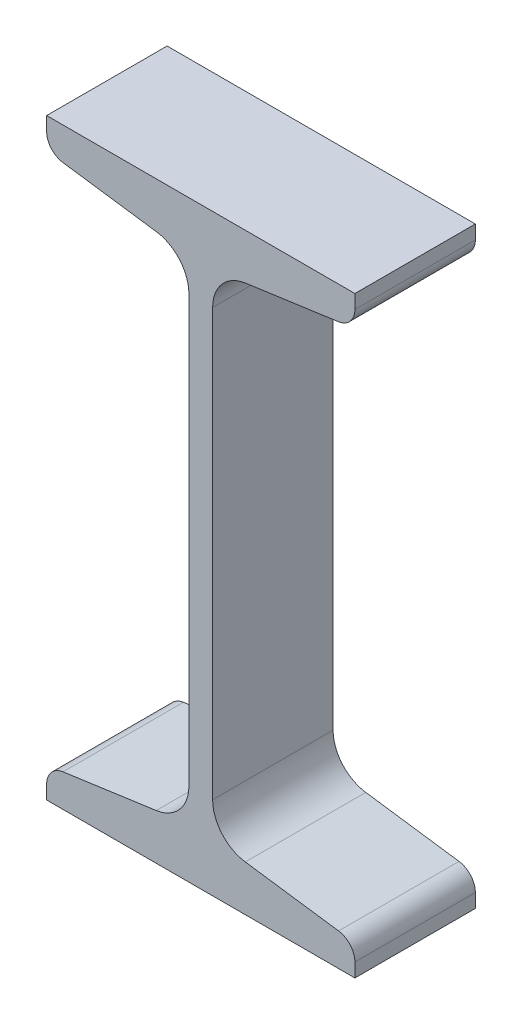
SolidWorks part; units mm, degrees
ref_plane "Front Plane" through (0, 0, 0) normal (0, 0, 1) x (1, 0, 0)
ref_plane "Top Plane" through (0, 0, 0) normal (0, 1, 0) x (1, 0, 0)
ref_plane "Right Plane" through (0, 0, 0) normal (1, 0, 0) x (0, 0, -1)
other "Configuration Table"
sketch "Sketch1" plane through (0, 0, 0) normal (0, 0, 1) x (1, 0, 0)
  line L0 (0, 72.9931) -> (0, -63.9253) construction
  line L1 (-32.5, 62.5) -> (32.5, 62.5)
  line L2 (-32.5, 62.5) -> (-32.5, 59.5853)
  line L3 (-32.5, -62.5) -> (32.5, -62.5)
  line L4 (32.5, -59.5853) -> (32.5, -62.5)
  line L5 (-42.3074, 0) -> (60.8749, 0) construction
  line L6 (-32.5, -59.5853) -> (-32.5, -62.5)
  line L7 (-29.0567, 55.6242) -> (-9.3866, 52.8597)
  line L8 (29.0567, -55.6242) -> (9.3866, -52.8597)
  line L9 (-29.0567, -55.6242) -> (-9.3866, -52.8597)
  line L10 (-2.5, 44.9376) -> (-2.5, -44.9376)
  line L11 (2.5, 44.9376) -> (2.5, -44.9376)
  line L12 (29.0567, 55.6242) -> (9.3866, 52.8597)
  line L13 (32.5, 62.5) -> (32.5, 59.5853)
  line L14 (-32.5, 21.4066) -> (-2.5, 21.4066) construction
  line L15 (-17.5, 62.5) -> (-17.5, 54) construction
  line L16 (-17.5, 54) -> (-17.5, 21.4066) construction
  arc A0 (-9.3866, 52.8597) -> (-2.5, 44.9376) centre (-10.5, 44.9376) cw
  arc A1 (-9.3866, -52.8597) -> (-2.5, -44.9376) centre (-10.5, -44.9376) ccw
  arc A2 (9.3866, -52.8597) -> (2.5, -44.9376) centre (10.5, -44.9376) cw
  arc A3 (9.3866, 52.8597) -> (2.5, 44.9376) centre (10.5, 44.9376) ccw
  arc A4 (-32.5, 59.5853) -> (-29.0567, 55.6242) centre (-28.5, 59.5853) ccw
  arc A5 (-32.5, -59.5853) -> (-29.0567, -55.6242) centre (-28.5, -59.5853) cw
  arc A6 (32.5, -59.5853) -> (29.0567, -55.6242) centre (28.5, -59.5853) ccw
  arc A7 (29.0567, 55.6242) -> (32.5, 59.5853) centre (28.5, 59.5853) ccw
  point P18 (0, -62.5)
  point P27 (0, 62.5)
  point P34 (-32.5, 56.1081)
  point P37 (-32.5, -56.1081)
  point P40 (32.5, -56.1081)
  point P43 (32.5, 56.1081)
  dimension "Radius_root" = 8
  dimension "Radius_toe" = 4
  dimension "Depth" = 125
  dimension "Width" = 65
  dimension "Web_thickness" = 5
  dimension "Thickness" = 8.5
  dimension "D1" = 98
extrude "BaseSection" add sketch "Sketch1" along normal mid plane 25.4
